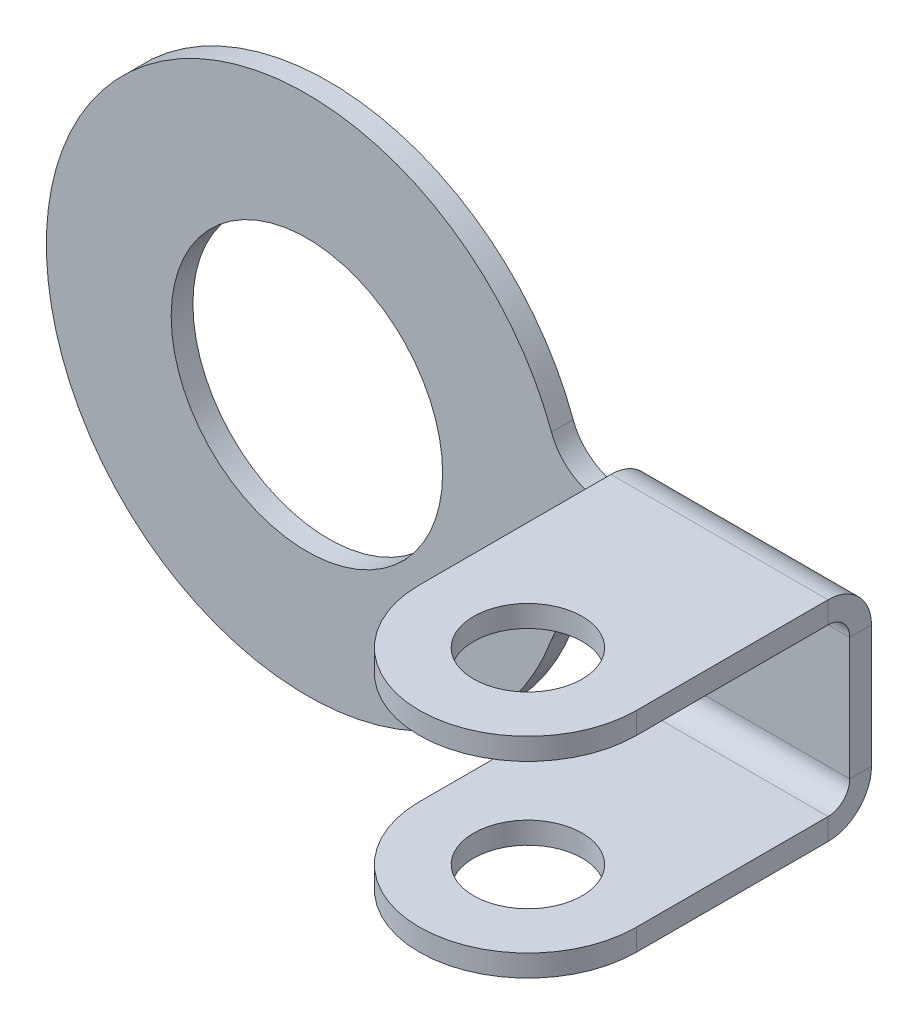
SolidWorks part; units mm, degrees
ref_plane "Plan1" through (0, 0, 0) normal (0, 0, 1) x (1, 0, 0)
ref_plane "Plan2" through (0, 0, 0) normal (0, 1, 0) x (1, 0, 0)
ref_plane "Plan3" through (0, 0, 0) normal (1, 0, 0) x (0, 0, -1)
sketch "Esquisse1" plane through (0, 0, 0) normal (0, 0, 1) x (1, 0, 0)
  line L0 (-38.7406, 23) -> (42.6345, 23) construction
  line L1 (40, 51) -> (40, -5)
  line L2 (20, 51) -> (20, 29)
  line L3 (20, 17) -> (20, -5)
  line L5 (17.2213, 28) -> (19, 28)
  line L6 (17.2213, 18) -> (19, 18)
  circle A0 centre (-10, 23) radius 12.5
  arc A1 (12.528, 31.2759) -> (12.528, 14.7241) centre (-10, 23) ccw
  circle A2 centre (30, 51) radius 5
  arc A3 (20, 51) -> (40, 51) centre (30, 51) cw
  circle A4 centre (30, -5) radius 5
  arc A5 (20, -5) -> (40, -5) centre (30, -5) ccw
  arc A6 (12.528, 31.2759) -> (17.2213, 28) centre (17.2213, 33) ccw
  arc A7 (12.528, 14.7241) -> (17.2213, 18) centre (17.2213, 13) cw
  arc A8 (19, 28) -> (20, 29) centre (19, 29) ccw
  arc A9 (19, 18) -> (20, 17) centre (19, 17) cw
  point P14 (40, 23)
extrude "Base-Extrusion" add sketch "Esquisse1" against normal blind 2
sheet metal parameters "Tôlerie 1" parameters "D1"=2
flatten bends "Dépliage 1" parameters "D1"=0
sketch "Esquisse-Angle1" plane through (0, 0, 0) normal (0, 0, 1) x (1, 0, 0)
process bends "Pliage 1" parameters "D1"=0
sketch "Esquisse-Plate1" plane through (0, 0, 0) normal (0, 0, 1) x (1, 0, 0)
  line L0 (20, 31) -> (50, 31) construction
  line L2 (20, 15) -> (50, 15) construction
  point P2 (30, 27)
bend "Pli défini à plat1" bend angle 90 parameters "D1"=0, "D5"=1
bend "Pli défini à plat2" bend angle 90 parameters "D1"=0, "D5"=2
